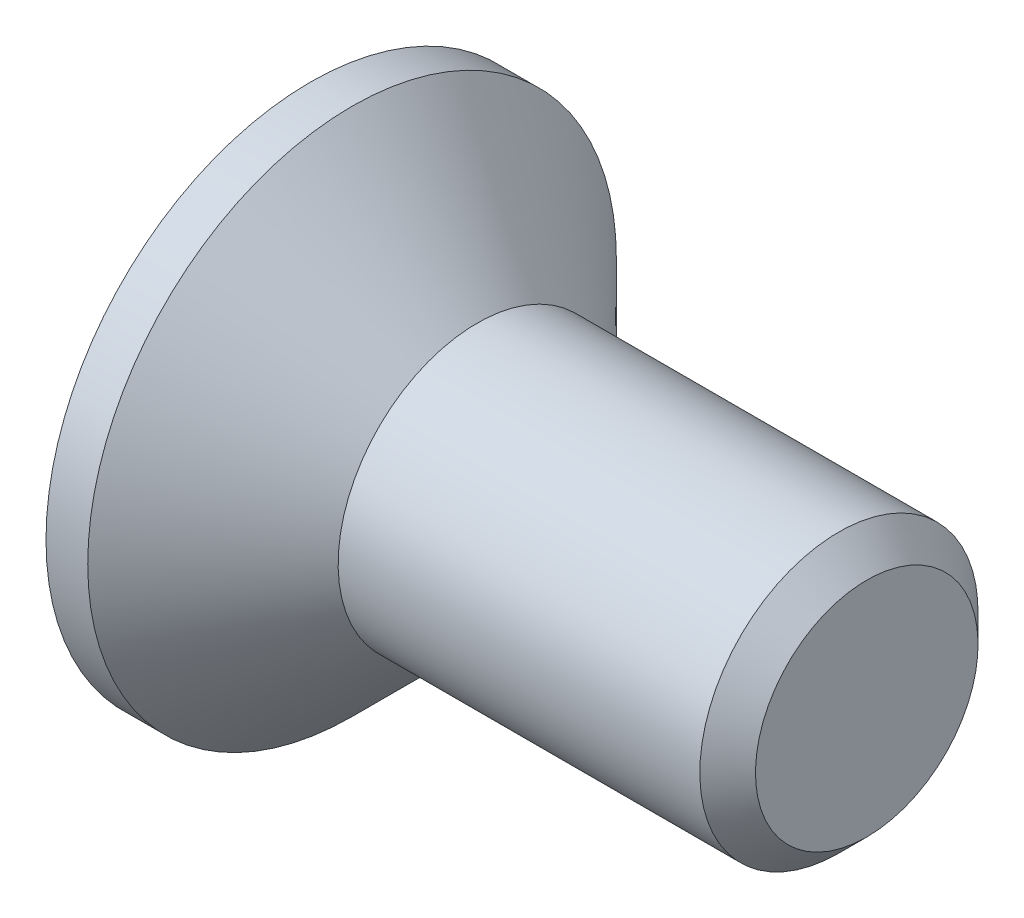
SolidWorks part; units mm, degrees
ref_plane "Front Plane" through (0, 0, 0) normal (0, 0, 1) x (1, 0, 0)
ref_plane "Top Plane" through (0, 0, 0) normal (0, 1, 0) x (1, 0, 0)
ref_plane "Right Plane" through (0, 0, 0) normal (1, 0, 0) x (0, 0, -1)
sketch "Sketch1" plane through (0, 0, 0) normal (0, 0, 1) x (1, 0, 0)
  line L1 (-1.2, 1.9) -> (-1.2, 0)
  line L2 (-1.2, 0) -> (2.8, 0)
  line L3 (2.8, 0) -> (2.8, 1)
  line L4 (2.8, 1) -> (0, 1)
  line L5 (-1.2, 1.9) -> (-0.9, 1.9)
  line L6 (-0.9, 1.9) -> (0, 1)
  dimension "D1" = 1
  dimension "D2" = 45
  dimension "D3" = 1.2
  dimension "D4" = 4
  dimension "D5" = 1.9
revolve "Revolve1" add sketch "Sketch1" angle 360 about L2
chamfer "Chamfer1" distance 0.2 angle 45 1 edges at (2.8, -1, 0)
sketch "Sketch2" plane through (-1.2, 0, 0) normal (-1, 0, 0) x (0, 0, 1)
  line L0 (-0.3, 1.175) -> (0.3, 1.175)
  line L1 (0.3, 1.175) -> (0.3, 0.3)
  line L2 (0.3, 0.3) -> (1.175, 0.3)
  line L3 (1.175, 0.3) -> (1.175, -0.3)
  line L4 (1.175, -0.3) -> (0.3, -0.3)
  line L5 (0.3, -0.3) -> (0.3, -1.175)
  line L6 (0.3, -1.175) -> (-0.3, -1.175)
  line L7 (-0.3, -1.175) -> (-0.3, -0.3)
  line L8 (-0.3, -0.3) -> (-1.175, -0.3)
  line L9 (-1.175, -0.3) -> (-1.175, 0.3)
  line L10 (-1.175, 0.3) -> (-0.3, 0.3)
  line L11 (-0.3, 0.3) -> (-0.3, 1.175)
  point P5 (0, 1.175)
  point P13 (1.175, 0)
  point P15 (-1.175, 0)
  point P16 (0, -1.175)
  point P17 (0.3, 1.085)
  dimension "D1" = 0.6
  dimension "D2" = 2.35
extrude "Cut-Extrude1" cut sketch "Sketch2" against normal blind 0.95
